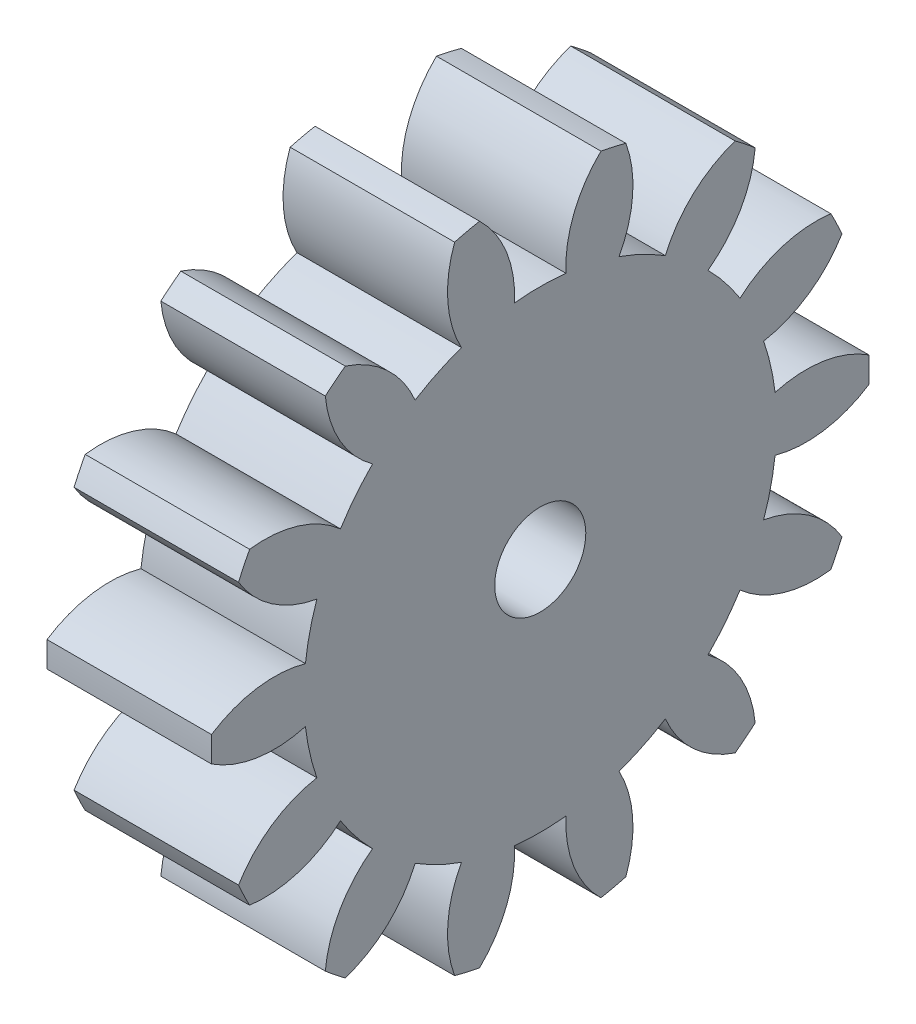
SolidWorks part; units mm, degrees
ref_plane "Plane1" through (0, 0, 0) normal (0, 0, 1) x (1, 0, 0)
ref_plane "Plane2" through (0, 0, 0) normal (0, 1, 0) x (1, 0, 0)
ref_plane "Plane3" through (0, 0, 0) normal (1, 0, 0) x (0, 0, -1)
sketch "HoldingSke" plane through (0, 0, 0) normal (0, 1, 0) x (1, 0, 0)
  line L0 (0, 0) -> (394.3282, -98.3171)
  line L1 (-15, 0) -> (100, 0) construction
  line L2 (0, 0) -> (-2.1039, 2.3779)
  line L3 (0, 0) -> (-11.863, 4.5341)
  line L4 (0, 0) -> (8.3795, 2.0892)
  line L5 (0, 0) -> (-47.5972, -17.7524)
  line L6 (0, 0) -> (-5.2639, -3.5516)
  line L7 (-2.1039, 2.3779) -> (8.8308, 51.9871)
  line L8 (-76.2, 54.61) -> (-69.596, 54.61)
  line L9 (-67.7845, 28.3722) -> (-49.3413, 33.142)
  line L10 (-76.2, 71.12) -> (104.1128, 71.12)
  line L11 (0, 0) -> (-6.35, 0)
  line L12 (-76.2, 101.6) -> (-76.1428, 101.6)
  line L13 (24.9733, 27.94) -> (52.9518, 28.4284)
  line L14 (24.9733, 27.94) -> (24.9746, 27.94)
  line L15 (24.9733, 27.94) -> (100.4006, 29.5858)
  circle A0 centre (0, 0) radius 3.175
  circle A1 centre (0, 0) radius 9.1269
  circle A2 centre (0, 0) radius 38.1
  circle A3 centre (0, 0) radius 3.175
  dimension "MHD" = 18.2537
  dimension "Hub_dia" = 76.2
  dimension "Bore" = 6.35
  dimension "MBD" = 6.35
  dimension "Num_teeth" = 14
  dimension "Pitch_radius" = 180.3128
  dimension "Pitch" = 406.4
  dimension "Width" = 6.35
  dimension "Overall_len" = 50.8
  dimension "Show_teeth" = 14
  dimension "Thickness" = 6.35
  dimension "OAL" = 50.8001
  dimension "T_dim" = 6.604
  dimension "Ap" = 14.5
  dimension "H" = 19.05
  dimension "Backlash" = 0.0571
  dimension "Addendum_fac" = 1
  dimension "Dedendum_fac" = 1.25
  dimension "Clearance_fac" = 0.25
  dimension "Dedendum_add" = 0.0013
sketch "BasProSke" plane through (0, 0, 0) normal (0, 1, 0) x (1, 0, 0)
  line L0 (-10, 0) -> (60, 0) construction
  line L1 (0, 0) -> (0, 12.7)
  line L2 (0, 0) -> (6.35, 0)
  line L3 (6.35, 0) -> (6.35, 12.7)
  line L4 (6.35, 12.7) -> (0, 12.7)
  dimension "Diameter" = 25.4
  dimension "Thickness" = 6.35
revolve "Base-Revolve" add sketch "BasProSke" angle 360 about L0
sketch "TooCutSke" plane through (0, 0, 0) normal (1, 0, 0) x (0, 0, -1)
  line L1 (0, 0) -> (0, 107) construction
  line L2 (0, 0) -> (-1.3441, 11.0309) construction
  line L3 (0, 0) -> (-4.9192, 21.5526) construction
  line L4 (-1.3441, 11.0309) -> (-2.4596, 10.7763) construction
  arc A0 (0.9926, 9.0727) -> (-0.9926, 9.0727) centre (0, 0) ccw
  arc A1 (2.3654, 12.5036) -> (-2.3654, 12.5036) centre (0, 0) ccw
  circle A2 centre (0, 0) radius 11.1125 construction
  circle A3 centre (0, 0) radius 10.7585 construction
  arc A4 (-0.9926, 9.0727) -> (-2.3654, 12.5036) centre (-5.4324, 9.2863) ccw
  arc A5 (2.3654, 12.5036) -> (0.9926, 9.0727) centre (5.4324, 9.2863) ccw
  dimension "Root_dia" = 18.2537
  dimension "Overcut_dia" = 25.4508
  dimension "Pitch_dia" = 22.225
  dimension "Base_dia" = 21.5171
  dimension "Flank_rad" = 4.445
  dimension "Half_ang" = 12.857
  dimension "Half_CT" = 1.1442
extrude "ToothCut" cut sketch "TooCutSke" along normal through all
fillet "Breaks" [suppressed] radius 0.0318
fillet "RootFillets" [suppressed] radius 0.3981
pattern_circular "TeethCuts" count 14 every 25.714 about axis through (-10, 0, 0) along (1, 0, 0) of "ToothCut", "RootFillets", "Breaks"
sketch "HubNeaOneSke" plane through (0, 0, 0) normal (-1, 0, 0) x (0, 0, 1)
  circle A0 centre (0, 0) radius 9.1269
  dimension "Diameter" = 18.2537
extrude "HubNearOne" [suppressed] add sketch "HubNeaOneSke" along normal blind 44.4501
sketch "HubNeaBotSke" plane through (0, 0, 0) normal (-1, 0, 0) x (0, 0, 1)
  circle A0 centre (0, 0) radius 9.1269
  dimension "Diameter" = 18.2537
extrude "HubNearBoth" [suppressed] add sketch "HubNeaBotSke" along normal blind 22.225
ref_plane "FarPln" through (6.35, 0, 0) normal (1, 0, 0) x (0, 0, -1)
sketch "HubFarSke" plane through (6.35, 0, 0) normal (1, 0, 0) x (0, 0, -1)
  circle A0 centre (0, 0) radius 9.1269
  dimension "Diameter" = 18.2537
extrude "HubFar" [suppressed] add sketch "HubFarSke" along normal blind 22.225
sketch "BorSke" plane through (0, 0, 0) normal (1, 0, 0) x (0, 0, -1)
  circle A0 centre (0, 0) radius 3.175
  dimension "Diameter" = 6.35
extrude "Bore" cut sketch "BorSke" along normal mid plane 101.6001
sketch "KeySke" plane through (0, 0, 0) normal (1, 0, 0) x (0, 0, -1)
  line L0 (-0.127, 0) -> (-0.127, 3.429)
  line L1 (-0.127, 3.429) -> (0.127, 3.429)
  line L2 (0.127, 3.429) -> (0.127, 0)
  line L3 (0, 0) -> (0, 34) construction
  line L4 (-0.127, 0) -> (0.127, 0)
  dimension "Offset" = 3.429
  dimension "Width" = 0.254
extrude "Keyway" [suppressed] cut sketch "KeySke" along normal mid plane 101.6001
pattern_circular "Keyway2" [suppressed] count 2 every 90 about axis through (-10, 0, 0) along (1, 0, 0)
sketch "Sketch1" plane through (0, 0, 0) normal (1, 0, 0) x (0, 0, -1)
  circle A0 centre (0, 0) radius 3.175
  circle A1 centre (0, 0) radius 1.759
  dimension "D1" = 3.5179
extrude "Boss-Extrude1" add sketch "Sketch1" along normal blind 6.35
scale "Scale1" scale about centroid uniform scaling yes scale factor 0.5
equation "' \"Pitch@HoldingSke\" = 4"
equation "' \"Num_teeth@HoldingSke\" = 12"
equation "' \"Ap@HoldingSke\" =  20"
equation "' \"Width@HoldingSke\" = 0.5"
equation "' \"Hub_dia@HoldingSke\"= 1"
equation "' \"Overall_len@HoldingSke\" = 1.0"
equation "' \"Bore@HoldingSke\" = 0.75"
equation "' \"T_dim@HoldingSke\" = 0.85"
equation "' \"Width@KeySke\" = 0.25"
equation "' \"Show_teeth@HoldingSke\" = 13"
equation "' \"Backlash@HoldingSke\" = 0.009"
equation "' \"Addendum_fac@HoldingSke\" = 1.0"
equation "' \"Dedendum_fac@HoldingSke\" = 1.25"
equation "' \"Dedendum_add@HoldingSke\" = 0.00005"
equation "' \"Clearance_fac@HoldingSke\" = 0.25"
equation "' \"Pitch@HoldingSke\" = 0.5"
equation "' \"Num_teeth@HoldingSke\" = 23"
equation "' \"Show_teeth@HoldingSke\" = 23"
equation "' \"Backlash@HoldingSke\" = 0.0375"
equation "\"Overcut_dia@TooCutSke\" = (\"Num_teeth@HoldingSke\" + 2 * \"Addendum_fac@HoldingSke\") / \"Pitch@HoldingSke\" + 0.002"
equation "\"Pitch_dia@TooCutSke\" = \"Num_teeth@HoldingSke\" / \"Pitch@HoldingSke\""
equation "\"Base_dia@TooCutSke\" = \"Num_teeth@HoldingSke\" / \"Pitch@HoldingSke\" * cos((\"Ap@HoldingSke\"  * 3.14159265 / 180))"
equation "\"Root_dia@TooCutSke\" = (\"Num_teeth@HoldingSke\" + 2) / \"Pitch@HoldingSke\" - 2 * (\"Addendum_fac@HoldingSke\" + \"Dedendum_fac@HoldingSke\") / \"Pitch@HoldingSke\" - \"Dedendum_add@HoldingSke\" * 2"
equation "\"Half_ang@TooCutSke\" = 180 / \"Num_teeth@HoldingSke\""
equation "\"Half_CT@TooCutSke\" = \"Num_teeth@HoldingSke\" / \"Pitch@HoldingSke\" * sin((3.14159265 / 2 / \"Num_teeth@HoldingSke\")) / 2 - 7 * \"Backlash@HoldingSke\" / 4"
equation "\"Flank_rad@TooCutSke\" = \"Num_teeth@HoldingSke\" / \"Pitch@HoldingSke\" / 5"
equation "\"Radius@RootFillets\" = \"Clearance_fac@HoldingSke\" / \"Pitch@HoldingSke\" + \"Dedendum_add@HoldingSke\""
equation "\"Break_rad@Breaks\" = 0.02 / \"Pitch@HoldingSke\""
equation "\"Thickness@HoldingSke\" = \"Width@HoldingSke\""
equation "\"OAL@HoldingSke\" = \"Thickness@HoldingSke\""
equation "\"MHD@HoldingSke\" = (\"Num_teeth@HoldingSke\" + 2) / \"Pitch@HoldingSke\" - 2 * (\"Addendum_fac@HoldingSke\" + \"Dedendum_fac@HoldingSke\")  / \"Pitch@HoldingSke\" - \"Dedendum_add@HoldingSke\" * 2"
equation "\"MBD@HoldingSke\" = (\"Num_teeth@HoldingSke\" + 2) / \"Pitch@HoldingSke\" - 2 * (\"Addendum_fac@HoldingSke\" + \"Dedendum_fac@HoldingSke\")  / \"Pitch@HoldingSke\" - \"Dedendum_add@HoldingSke\" * 2 - 0.002"
equation "\"MHD@HoldingSke\" = ((sgn( \"MHD@HoldingSke\" - \"Hub_dia@HoldingSke\" )-1)*( \"MHD@HoldingSke\" - \"Hub_dia@HoldingSke\" ))/-2+ \"Hub_dia@HoldingSke\""
equation "\"MBD@HoldingSke\" = ((sgn( \"MBD@HoldingSke\" - \"Bore@HoldingSke\" )-1)*( \"MBD@HoldingSke\" - \"Bore@HoldingSke\" ))/-2+ \"Bore@HoldingSke\""
equation "\"OAL@HoldingSke\" = ((sgn( \"OAL@HoldingSke\" - \"Overall_len@HoldingSke\" )+1)*( \"OAL@HoldingSke\" - \"Overall_len@HoldingSke\" ))/2 + \"Overall_len@HoldingSke\" + 0.000002"
equation "\"Num_teeth@TeethCuts\" = int( \"Show_teeth@HoldingSke\" ) + 1"
equation "\"Num_teeth@TeethCuts\" = ((sgn( \"Num_teeth@TeethCuts\" - \"Num_teeth@HoldingSke\" )-1)*( \"Num_teeth@TeethCuts\" - \"Num_teeth@HoldingSke\" ))/-2+ \"Num_teeth@HoldingSke\""
equation "\"Num_teeth@TeethCuts\" = ((sgn( \"Num_teeth@TeethCuts\" - 2.0)+1)*( \"Num_teeth@TeethCuts\" - 2.0))/2 +2.0"
equation "\"Angle@TeethCuts\" = 360.0 / \"Num_teeth@HoldingSke\""
equation "\"Diameter@BasProSke\" = (\"Num_teeth@HoldingSke\" + 2 * \"Addendum_fac@HoldingSke\") / \"Pitch@HoldingSke\""
equation "\"Thickness@BasProSke\"  = \"Thickness@HoldingSke\""
equation "' \"Fillet_rad@BasProSke\" =  \"Thickness@HoldingSke\" * 0.05"
equation "\"MHD@HoldingSke\" = ((sgn( \"MHD@HoldingSke\" - \"Root_dia@TooCutSke\" )-1)*( \"MHD@HoldingSke\" - \"Root_dia@TooCutSke\" ))/-2+ \"Root_dia@TooCutSke\""
equation "\"Diameter@HubNeaOneSke\" = \"MHD@HoldingSke\""
equation "\"Length@HubNearOne\" = \"OAL@HoldingSke\" - \"Thickness@BasProSke\""
equation "\"Diameter@HubNeaBotSke\" = \"MHD@HoldingSke\""
equation "\"Length@HubNearBoth\" = ( \"OAL@HoldingSke\" - \"Thickness@BasProSke\" ) / 2.0"
equation "\"Thickness@FarPln\" = \"Thickness@BasProSke\""
equation "\"Diameter@HubFarSke\" = \"MHD@HoldingSke\""
equation "\"Length@HubFar\" = ( \"OAL@HoldingSke\" - \"Thickness@BasProSke\" ) / 2.0"
equation "\"Diameter@BorSke\" = \"MBD@HoldingSke\""
equation "\"D1@Bore\" = \"OAL@HoldingSke\" * 2.0"
equation "\"D1@Keyway\" = \"OAL@HoldingSke\" * 2.0"
equation "\"Offset@KeySke\" = \"T_dim@HoldingSke\" - \"MBD@HoldingSke\" / 2.0"
